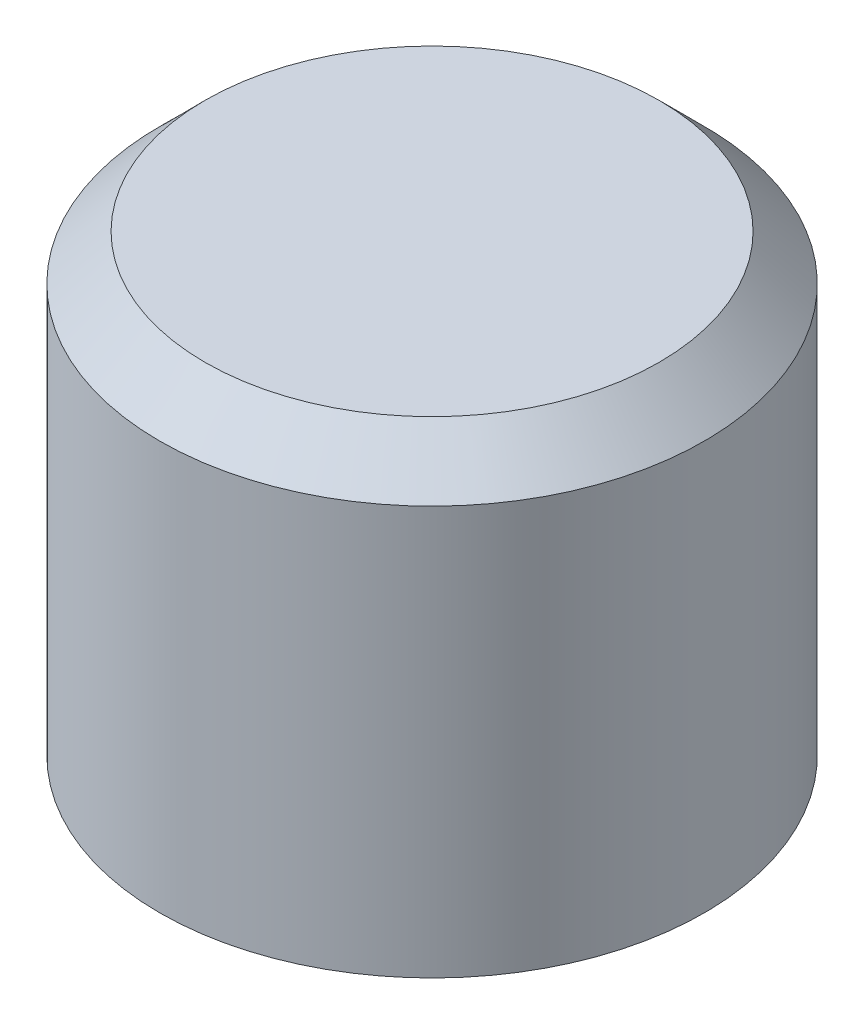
SolidWorks part; units mm, degrees
ref_plane "Front Plane" through (0, 0, 0) normal (0, 0, 1) x (1, 0, 0)
ref_plane "Top Plane" through (0, 0, 0) normal (0, 1, 0) x (1, 0, 0)
ref_plane "Right Plane" through (0, 0, 0) normal (1, 0, 0) x (0, 0, -1)
sketch "Sketch1" plane through (0, 0, 0) normal (0, 1, 0) x (1, 0, 0)
  circle A0 centre (0, 0) radius 6
  dimension "D1" = 12
extrude "Boss-Extrude1" add sketch "Sketch1" along normal blind 10
chamfer "Chamfer1" distance 1 1 edges at (0, 10, 6)
hole_wizard "M8x1.0 Tapped Hole1" positions "3DSketch2" profile "Sketch5" tap size "M8x1.0" standard "ANSI Metric"
sketch3d "3DSketch2"
  line L0 (0, 9, 0) -> (0, 0, 0) construction
  point P0 (0, 0, 0)
  point P4 (0, 0, 0)
  point P8 (0, 0, 0)
  point P10 (-0.1166, 0, -0.0306)
  point P12 (0, 0, 0)
sketch "Sketch5" plane through (-0.1166, 0, -0.0306) normal (1, 0, 0) x (0, 0, -1)
  line L0 (0, 0) -> (0, 8.103)
  line L1 (0, 8.103) -> (3.5, 6)
  line L2 (3.5, 6) -> (3.5, 0)
  line L5 (3.5, 0) -> (0, 0)
  line L10 (0, 8.103) -> (-3.5, 6) construction
  line L11 (0, -6.35) -> (0, 107.95) construction
  dimension "Tap Drill Dia." = 7
  dimension "Tap Drill Depth" = 6
  dimension "Drill Angle" = 118
